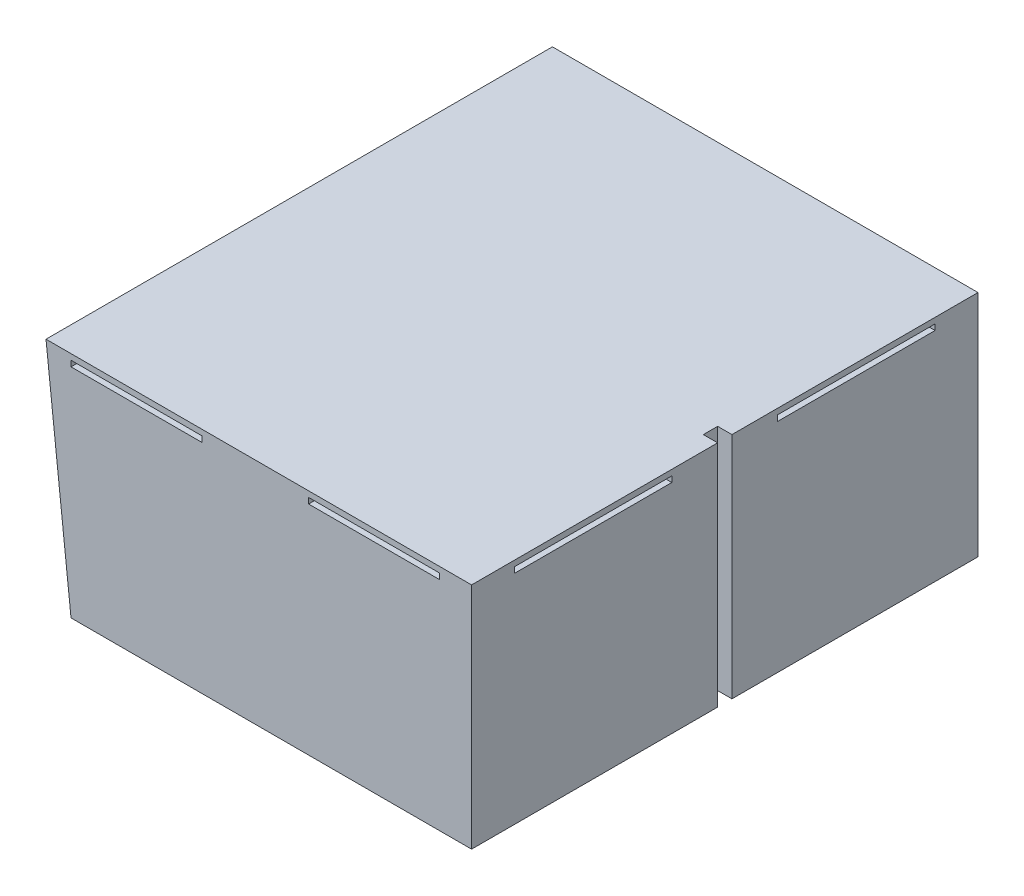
SolidWorks part; units mm, degrees
ref_plane "Front Plane" through (0, 0, 0) normal (0, 0, 1) x (1, 0, 0)
ref_plane "Top Plane" through (0, 0, 0) normal (0, 1, 0) x (1, 0, 0)
ref_plane "Right Plane" through (0, 0, 0) normal (1, 0, 0) x (0, 0, -1)
sketch "Sketch1" plane through (0, 0, 0) normal (0, 0, 1) x (1, 0, 0)
  line L0 (0, 0) -> (1400, 0)
  line L1 (0, 0) -> (-87.473, 800)
  line L2 (-87.473, 800) -> (1400, 800)
  line L3 (1400, 800) -> (1400, 0)
  dimension "D1" = 1400
  dimension "D2" = 96.24
  dimension "D3" = 800
extrude "Boss-Extrude1" add sketch "Sketch1" along normal blind 1770
sketch "Sketch2" plane through (0, 0, 1770) normal (0, 0, 1) x (1, 0, 0)
  line L0 (1400, 800) -> (-87.473, 800) construction
  line L1 (0, 780) -> (457.4318, 780)
  line L2 (0, 780) -> (0, 760)
  line L3 (0, 760) -> (457.4318, 760)
  line L4 (457.4318, 780) -> (457.4318, 760)
  line L5 (830.3037, 780) -> (1287.7355, 780)
  line L6 (830.3037, 780) -> (830.3037, 760)
  line L7 (830.3037, 760) -> (1287.7355, 760)
  line L8 (1287.7355, 780) -> (1287.7355, 760)
  dimension "D1" = 20
  dimension "D2" = 20
  dimension "D3" = 20
  dimension "D4" = 20
extrude "Cut-Extrude1" cut sketch "Sketch2" against normal through all
sketch "Sketch3" plane through (1400, 0, 0) normal (1, 0, 0) x (0, 0, -1)
  line L0 (0, 0) -> (0, 800) construction
  line L1 (-1620, 780) -> (-1070, 780)
  line L2 (-1620, 780) -> (-1620, 760)
  line L3 (-1620, 760) -> (-1070, 760)
  line L4 (-1070, 780) -> (-1070, 760)
  line L5 (-700, 780) -> (-150, 780)
  line L6 (-700, 780) -> (-700, 760)
  line L7 (-700, 760) -> (-150, 760)
  line L8 (-150, 780) -> (-150, 760)
  line L9 (-1770, 0) -> (-1770, 800) construction
  line L10 (-1770, 800) -> (0, 800) construction
  dimension "D1" = 550
  dimension "D2" = 550
  dimension "D3" = 150
  dimension "D4" = 150
  dimension "D5" = 20
  dimension "D6" = 20
  dimension "D7" = 20
  dimension "D8" = 20
extrude "Cut-Extrude2" cut sketch "Sketch3" against normal through all
sketch "Sketch4" plane through (1400, 0, 0) normal (1, 0, 0) x (0, 0, -1)
  line L0 (-1770, 800) -> (0, 800) construction
  line L1 (-910, 800) -> (-860, 800)
  line L2 (-910, 800) -> (-910, 0)
  line L3 (-910, 0) -> (-860, 0)
  line L4 (-860, 800) -> (-860, 0)
  line L5 (-1770, 0) -> (0, 0) construction
  line L6 (-885, 0) -> (-885, 92.9841) construction
  line L7 (-885, 800) -> (-885, 695.3686) construction
  dimension "D1" = 50
extrude "Cut-Extrude3" cut sketch "Sketch4" against normal blind 50
